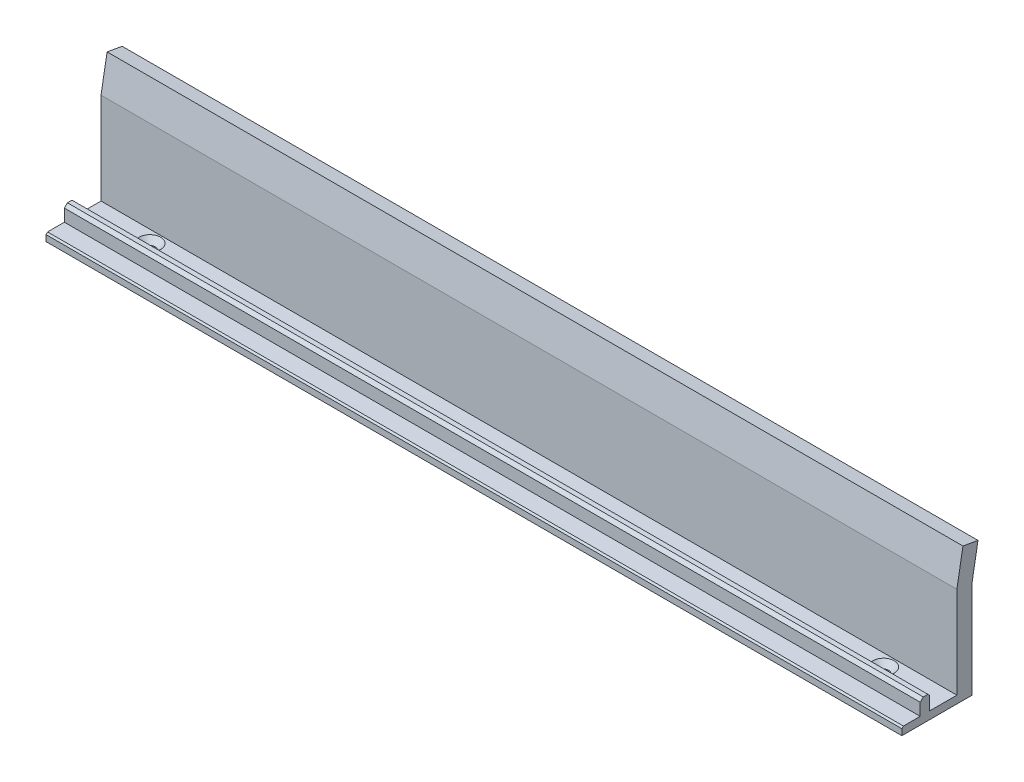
SolidWorks part; units mm, degrees
ref_plane "Ebene vorne" through (0, 0, 0) normal (0, 0, 1) x (1, 0, 0)
ref_plane "Ebene oben" through (0, 0, 0) normal (0, 1, 0) x (1, 0, 0)
ref_plane "Ebene rechts" through (0, 0, 0) normal (1, 0, 0) x (0, 0, -1)
sketch "Skizze1" plane through (0, 0, 0) normal (0, 1, 0) x (1, 0, 0)
  line L1 (-140, -11.5) -> (140, -11.5)
  line L2 (-140, -11.5) -> (-140, 11.5)
  line L3 (-140, 11.5) -> (140, 11.5)
  line L4 (140, -11.5) -> (140, 11.5)
  line L5 (-140, -11.5) -> (140, 11.5) construction
  line L6 (-140, 11.5) -> (140, -11.5) construction
  point P0 (0, 0)
  dimension "D1" = 280
  dimension "D2" = 23
extrude "Aufsatz-Linear austragen1" add sketch "Skizze1" along normal blind 3
sketch "Skizze2" plane through (0, 3, 0) normal (0, 1, 0) x (1, 0, 0)
  line L0 (-140, 11.5) -> (-140, -11.5) construction
  line L1 (-140, -2.5) -> (140, -2.5)
  line L2 (-140, -2.5) -> (-140, -5.5)
  line L3 (-140, -5.5) -> (140, -5.5)
  line L4 (140, -2.5) -> (140, -5.5)
  line L5 (140, -11.5) -> (140, 11.5) construction
  line L6 (-140, -11.5) -> (140, -11.5) construction
  dimension "D1" = 6
  dimension "D2" = 3
extrude "Aufsatz-Linear austragen2" add sketch "Skizze2" along normal blind 5
chamfer "Fase1" distance 0.5 angle 45 6 edges at (0, 3, 11.5) (0, 0, -11.5) (-140, 0, 0) (0, 0, 11.5) (140, 0, 0) (0, 8, 2.5)
chamfer "Fase2" distance 1 angle 45 1 edges at (0, 8, 5.5)
hole_wizard "Formsenkung für M3 Senkschraube mit Innensechskant1" positions "Skizze3" profile "Skizze4" countersink size "M3" standard "DIN"
sketch "Skizze3" plane through (0, 3, 0) normal (0, 1, 0) x (1, 0, 0)
  line L0 (140, -11.5) -> (-140, -11.5) construction
  line L3 (-140, 11.5) -> (-140, -2.5) construction
  line L4 (140, -2.5) -> (140, 11.5) construction
  point P0 (120, 2.5)
  point P4 (-120, 2.5)
  dimension "D1" = 14
  dimension "D2" = 20
  dimension "D3" = 20
sketch "Skizze4" plane through (120, 3, -2.5) normal (1, 0, 0) x (0, 0, 1)
  line L0 (0, 0) -> (0, 3)
  line L1 (0, 3) -> (1.7, 3)
  line L2 (1.7, 3) -> (1.7, 1.8)
  line L3 (1.7, 1.8) -> (3.5, 0)
  line L5 (3.5, 0) -> (0, 0)
  line L6 (-1.7, 1.8) -> (-3.5, 0) construction
  line L11 (0, -6.35) -> (0, 107.95) construction
  dimension "Bohrerdurchmesser" = 3.4
  dimension "Bohrungstiefe" = 3
  dimension "Senkdurchmesser (Oben)" = 7
  dimension "Senkwinkel (Oben)" = 90
sketch "Skizze5" plane through (140, 0, 0) normal (1, 0, 0) x (0, 0, -1)
  line L0 (11.5, 3) -> (11.5, 32.5626)
  line L1 (11.5, 32.5626) -> (13.4101, 43.3954)
  line L2 (13.4101, 43.3954) -> (8.4861, 44.2637)
  line L3 (8.4861, 44.2637) -> (6.5, 33)
  line L4 (6.5, 33) -> (6.5, 3)
  line L5 (-2.5, 3) -> (11.5, 3) construction
  line L6 (6.5, 3) -> (11.5, 3)
  dimension "D1" = 5
  dimension "D2" = 5
  dimension "D3" = 30
  dimension "D4" = 170
  dimension "D5" = 11
extrude "Aufsatz-Linear austragen3" add sketch "Skizze5" against normal up to surface (280 mm away)
